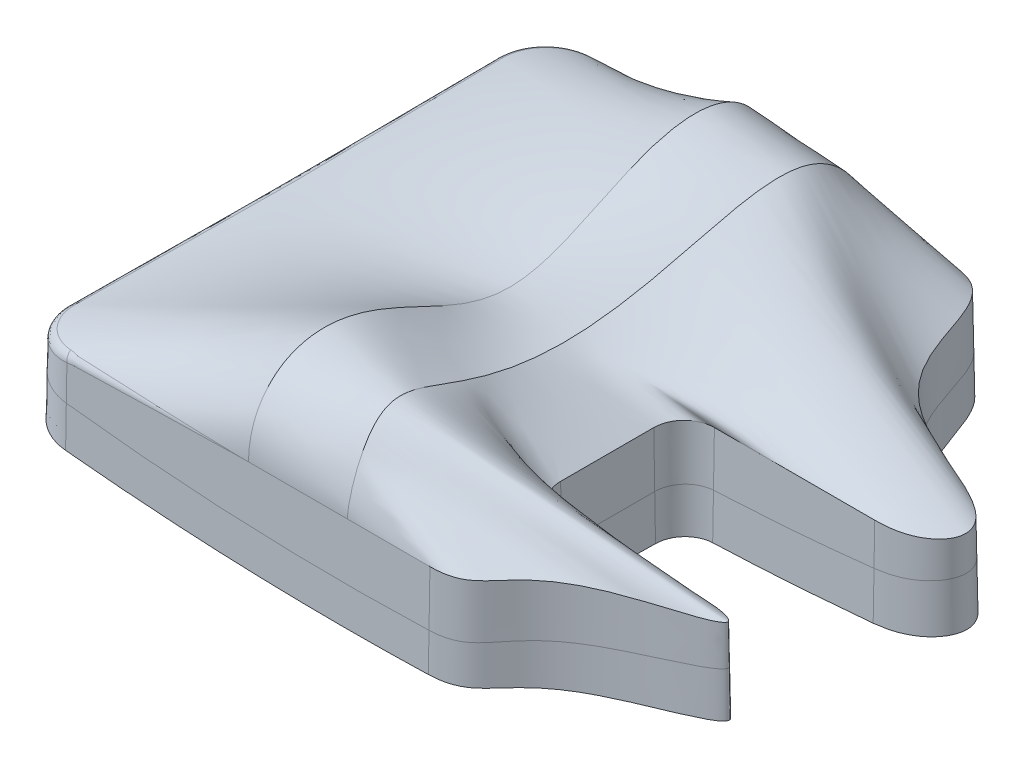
SolidWorks part; units mm, degrees
ref_plane "Front Plane" through (0, 0, 0) normal (0, 0, 1) x (1, 0, 0)
ref_plane "Top Plane" through (0, 0, 0) normal (0, 1, 0) x (1, 0, 0)
ref_plane "Right Plane" through (0, 0, 0) normal (1, 0, 0) x (0, 0, -1)
sketch "side sketch" plane through (0, 0, 0) normal (0, 0, 1) x (1, 0, 0)
  line L0 (0, 0) -> (142, 0) construction
  dimension "D1" = 142
sketch "Sketch2" plane through (0, 0, 0) normal (0, 0, 1) x (1, 0, 0)
  arc A0 (2, -22) -> (141, -22) centre (71.5, 573.9612) ccw
  point P3 (126.5, -23.5127)
  point P4 (25.5, -24.2729)
  point P5 (71.5, -26.0388)
  point P6 (0, 0)
  point P7 (0, 0)
  dimension "D1" = 600
  dimension "D2" = 22
  dimension "D3" = 2
  dimension "D4" = 139
  dimension "D5" = 55
  dimension "D6" = 46
sketch "side_smoke" plane through (0, 0, 0) normal (0, 0, 1) x (1, 0, 0)
  line L0 (3.5, -5.7802) -> (3.5, -8.0388) construction
  line L1 (3.5, -8.0388) -> (-11.5, 36) construction
  line L2 (-11.5, 36) -> (46.5, 28) construction
  line L3 (46.5, 28) -> (71.5, -71.0388) construction
  line L4 (71.5, -71.0388) -> (96.5, 28) construction
  line L5 (96.5, 28) -> (154.5, 36) construction
  line L6 (154.5, 36) -> (139.5, -8.0388) construction
  line L7 (139.5, -8.0388) -> (139.5, -5.7802) construction
  line L8 (71.5, -26.0388) -> (71.5, 118.356) construction
  arc A0 (3.5, -5.7802) -> (139.5, -5.7802) centre (71.5, 540) ccw
  arc A1 (2, -22) -> (141, -22) centre (71.5, 573.9612) ccw construction
  spline_without_curve S0
  point P3 (71.5, -10)
  point P4 (0, 0)
  point P5 (0, 0)
  point P13 (72.2321, -49.0173)
  point P14 (0, 0)
  point P15 (71.5, -72.5374)
  point P16 (0, 0)
  point P17 (71.5, -24.9262)
  point P18 (0, 0)
  point P19 (0, 0)
  point P20 (0, 0)
  point P21 (-6.2534, -17.0302)
  point P22 (3.0396, -8.1947)
  point P23 (0, 0)
  point P24 (141.4359, -2.8258)
  point P25 (146.4734, -5.6622)
  point P26 (-16.5, 36)
  point P27 (3.5, -6.5837)
  point P28 (0, 0)
  point P29 (0, 0)
  point P30 (0, 0)
  point P31 (0, 0)
  point P32 (0, 0)
  point P33 (0, 0)
ref_plane "right_plane" through (71.5507, 0, 0) normal (1, 0, 0) x (0, 0, -1)
sketch "right_side_smoke" plane through (71.5507, 0, 0) normal (1, 0, 0) x (0, 0, -1)
  line L0 (-54.7478, -7.8524) -> (55.2522, -7.8524) construction
  dimension "D1" = 110
sketch "Sketch7" plane through (71.5507, 0, 0) normal (1, 0, 0) x (0, 0, -1)
  arc A0 (55, -24.5835) -> (-55, -24.5835) centre (0, 1013.9612) cw
  point P3 (51.7591, -23.6324)
  point P4 (0, -26.0388)
  point P6 (0, 0)
  dimension "D1" = 1040
  dimension "D2" = 110
ref_plane "top_plane" through (0, -24.9381, 0) normal (0, 1, 0) x (1, 0, 0)
sketch "top_smoke" plane through (0, -24.9381, 0) normal (0, 1, 0) x (1, 0, 0)
  line L0 (51.7021, 57.6996) -> (50.2508, -50.1307) construction
  line L1 (-22.3362, 41.5701) -> (87.6638, 41.5701) construction
  point P4 (73.0576, -50.2135)
  point P5 (73.2358, -50.3341)
  dimension "D1" = 110
sketch "Sketch10" plane through (0, -24.9381, 0) normal (0, 1, 0) x (1, 0, 0)
  line L0 (2.8248, -45) -> (2.8248, 45)
  line L2 (12.8248, 55) -> (88.8248, 55)
  line L3 (2.8248, 0) -> (142.0694, 0) construction
  line L5 (12.8248, -55) -> (88.8248, -55)
  line L6 (122.6741, -31.5) -> (93.3884, -31.5)
  line L7 (93.3884, 0) -> (126.9566, 0)
  line L8 (88.8248, 55) -> (117.1528, 55) construction
  line L9 (87.3884, -25.5) -> (87.3884, -6)
  line L10 (117.1528, 55) -> (74.036, -6.0527) construction
  line L11 (74.036, -6.0527) -> (152.5402, 37.6831) construction
  line L12 (152.5402, 37.6831) -> (148.0627, 5.5651) construction
  line L13 (148.0627, 5.5651) -> (139.3029, 0) construction
  line L17 (139.3029, 0) -> (126.9566, 0) construction
  line L18 (88.8248, -55) -> (108.0821, -55) construction
  line L19 (108.0821, -55) -> (86.7311, -34.4421) construction
  line L20 (86.7311, -34.4421) -> (136.5026, -40.9296) construction
  line L21 (136.5026, -40.9296) -> (139.1754, -31.5) construction
  line L22 (139.1754, -31.5) -> (122.6741, -31.5) construction
  arc A0 (2.8248, 45) -> (12.8248, 55) centre (12.8248, 45) cw
  arc A3 (2.8248, -45) -> (12.8248, -55) centre (12.8248, -45) ccw
  arc A4 (93.3884, -31.5) -> (87.3884, -25.5) centre (93.3884, -25.5) cw
  arc A5 (87.3884, -6) -> (93.3884, 0) centre (93.3884, -6) cw
  spline_without_curve S0
  spline_without_curve S1
  point P3 (150.039, 39.6386)
  point P6 (74.5712, -1.441)
  point P8 (147.3346, 4.9109)
  point P9 (139.1754, -29.8798)
  point P10 (150.3044, 2.0381)
  point P11 (74.036, -6.0527)
  point P14 (152.5402, 37.6831)
  point P16 (148.0627, 5.5651)
  point P35 (108.0821, -53.1354)
  point P36 (2.8248, 0)
  point P37 (0, 0)
  point P38 (90.047, 57.1826)
  point P39 (86.7311, -34.4421)
  point P40 (2.8248, 1.6093)
  point P41 (0, 0)
  point P42 (0, 0)
  point P43 (0, 0)
  dimension "D1" = 90
  dimension "D5" = 19.5
  dimension "D6" = 6
  dimension "D2" = 10
  dimension "D7" = 74.036
  dimension "D4" = 68.6752
  dimension "D19" = 5.5651
  dimension "D20" = 37.6831
  dimension "D21" = 6.0527
  dimension "D22" = 34.4421
  dimension "D23" = 70.5187
  dimension "D24" = 9.4296
surface "Surface-Extrude1" sketch "Sketch10" parameters "D1"=40, "D3"=1
other "Boundary-Surface1"
surface "Surface-Trim2"
surface "Surface-Trim4"
sketch "Sketch12" plane through (71.5507, 0, 0) normal (1, 0, 0) x (0, 0, -1)
  line L9 (-54.6509, -4.9381) -> (-54.6509, 7.0619) construction
  line L10 (-54.6509, 7.0619) -> (-40.2851, 21.6067) construction
  line L11 (-40.2851, 21.6067) -> (-37.3184, 0.1528) construction
  line L13 (-37.3184, 0.1528) -> (0, 0.1528) construction
  line L14 (0, 8.9457) -> (0, -5.8451) construction
  line L17 (-54.6509, -4.9381) -> (-54.6509, 7.0619) construction
  line L18 (-54.6509, 7.0619) -> (-31.4071, 46.6672) construction
  line L19 (-31.4071, 46.6672) -> (-55.4523, -21.2066) construction
  line L20 (-55.4523, -21.2066) -> (25.3625, -21.2066) construction
  line L21 (25.3625, -21.2066) -> (24.9045, 46.6672) construction
  line L22 (24.9045, 46.6672) -> (54.6509, 7.0619) construction
  line L23 (54.6509, 7.0619) -> (54.6509, -4.9381) construction
  spline S0 degree 4 poles (-54.6509, -4.9381) (-54.6509, 7.0619) (-40.2851, 21.6067) (-37.3184, 0.1528) (0, 0.1528) knots 0 0 0 0 0 1 1 1 1 1
  spline_without_curve S1
  point P1 (52.9772, 11.3895)
  point P2 (-13.4504, 18.2963)
  point P4 (-54.6509, 6.7629)
  point P5 (-54.6509, 6.7629)
  point P10 (26.1624, 20.1246)
  point P11 (-11.6221, -18.8788)
  point P14 (14.3801, -12.1751)
  point P16 (0, 0)
  point P17 (-34.5772, 32.3131)
  point P24 (0, 0)
  point P25 (0, 0)
  point P26 (-24.2169, 28.8597)
  point P27 (0, 0)
  point P28 (-64.9269, 27.9723)
  point P29 (-55.5142, 21.0788)
  point P30 (0, 0)
  point P31 (-54.6509, 5.9759)
  point P32 (0, 0)
  point P33 (0, 0)
  point P34 (0, 0)
  point P35 (-61.4252, 27.7366)
  point P36 (-29.3824, -17.0373)
  point P37 (-48.7957, 30.4903)
  point P38 (6.3325, 37.9588)
  point P39 (-21.2228, 0.1528)
  point P40 (-45.4839, -22.1989)
  point P41 (17.0249, 38.3717)
  point P42 (25.3625, -23.6822)
  point P43 (0, 0)
  point P44 (-21.6267, 0.1528)
  point P45 (2.5499, -21.6795)
  point P46 (-29.8301, 0.1528)
  point P47 (-40.8624, 31.2993)
  point P48 (-30.0449, 0.1528)
  point P49 (-12.936, -27.7191)
  point P50 (-57.3991, 37.0586)
  point P51 (-15.21, -18.8247)
  point P52 (-60.2804, 50.8055)
  point P53 (-39.5404, 36.2297)
  point P54 (24.9045, 27.9949)
  point P55 (-44.0628, 23.8024)
  point P56 (-59.0296, 40.6281)
  point P57 (-48.0024, 40.1486)
  point P58 (-36.1178, -15.899)
  point P59 (-40.2234, 40.5869)
  point P60 (-30.0539, -20.2751)
  point P61 (-38.9766, 27.6628)
  point P63 (-37.3184, 0.1528)
  point P66 (-49.2864, -20.0531)
  point P67 (-40.2851, 21.6067)
  point P68 (-29.7076, 31.6499)
  point P69 (-23.2474, -24.4153)
  point P70 (-40.9802, -21.9881)
  point P71 (-30.4188, 47.6412)
  point P72 (-40.2575, 46.6672)
  point P73 (-55.4523, -21.2066)
  point P74 (0, 0)
  dimension "D1" = 24.9045
  dimension "D2" = 25.3625
  dimension "D3" = 31.4071
  dimension "D4" = 37.3184
  dimension "D5" = 40.2851
  dimension "D6" = 55.4523
  dimension "D7" = 21.6067
  dimension "D8" = 46.6672
  dimension "D9" = 14.5448
ref_plane "Plane4" through (25.5, 0, 0) normal (1, 0, 0) x (0, 0, -1)
sketch "Sketch15" plane through (25.5, 0, 0) normal (1, 0, 0) x (0, 0, -1)
  line L0 (-54.6509, -4.9381) -> (-54.6509, 7.0619) construction
  line L3 (-54.6509, 7.0619) -> (-29.6509, 19.6619) construction
  line L4 (-42, 7.8067) -> (0, 7.8067) construction
  line L7 (-29.6509, 19.6619) -> (-42, 7.8067) construction
  spline S1 degree 4 poles (-54.6509, -4.9381) (-54.6509, 7.0619) (-29.6509, 19.6619) (-42, 7.8067) (0, 7.8067) knots 0 0 0 0 0 1 1 1 1 1
  point P1 (-45.0685, 6.191)
  point P2 (-41.3093, 12.4958)
  point P4 (-17.0892, -7.3944)
  point P5 (0, 0)
  point P6 (0, 0)
  point P7 (-54.6509, 6.89)
  point P10 (-29.6509, 19.7318)
  point P13 (0, 0)
  point P14 (-30.3407, 14.2792)
  point P17 (-42.5415, 7.8067)
  dimension "D1" = 12
  dimension "D2" = 25
  dimension "D3" = 12.6
  dimension "D4" = 42
sketch "Sketch17" plane through (0, 0, 0) normal (0, 0, 1) x (1, 0, 0)
  line L2 (3.5, -5.7802) -> (3.5, -8.0388) construction
  line L3 (3.5, -8.0388) -> (-11.5, 36) construction
  line L4 (-11.5, 36) -> (46.5, 28) construction
  line L6 (46.5, 28) -> (71.5, -71.0388) construction
  line L9 (71.5, -71.0388) -> (96.5, 28) construction
  line L11 (96.5, 28) -> (154.5, 36) construction
  line L13 (154.5, 36) -> (139.5, -8.0388) construction
  line L16 (139.5, -8.0388) -> (139.5, -5.7802) construction
  line L17 (71.5, -26.0388) -> (71.5, 118.356) construction
  spline_without_curve S1
  point P2 (0, 0)
  point P3 (0, 0)
  dimension "D1" = 2.2586
  dimension "D5" = 58
  dimension "D7" = 58
  dimension "D8" = 15
  dimension "D9" = 45
ref_plane "Plane5" through (50.8248, 0, 0) normal (1, 0, 0) x (0, 0, -1)
sketch "Sketch19" plane through (50.8248, 0, 0) normal (1, 0, 0) x (0, 0, -1)
  line L5 (-54.6509, -4.9381) -> (-54.6509, 22.0619) construction
  line L6 (-54.6509, 22.0619) -> (-15, 26) construction
  line L9 (-15, 26) -> (-6, -21) construction
  line L10 (-6, -21) -> (6, -21) construction
  line L11 (6, -21) -> (15, 26) construction
  line L12 (15, 26) -> (54.6509, 22.0619) construction
  line L14 (54.6509, 22.0619) -> (54.6509, -4.9381) construction
  line L16 (-6, -25.8107) -> (-6, -4.9381) construction
  line L18 (0, -8.0388) -> (0, 36) construction
  line L19 (0, -26.0388) -> (0, 118.356) construction
  spline S0 degree 4 poles (-54.6509, -4.9381) (-54.6509, 7.0619) (-29.6509, 19.6619) (-42, 7.8067) (0, 7.8067) knots 0 0 0 0 0 1 1 1 1 1 construction
  spline_without_curve S1
  point P1 (6.448, 20.2623)
  point P2 (-54.6509, 17.58)
  point P3 (-11.5116, -13.5577)
  point P4 (10.9962, -9.7092)
  point P7 (21.3754, 27.8426)
  point P8 (-5.9138, 12.3321)
  point P9 (-54.6509, 27.8426)
  point P10 (26.0403, 41.0208)
  point P11 (-15.0102, 26.9097)
  point P12 (60.4434, 20.3789)
  point P13 (20.7923, 18.7462)
  point P14 (7.3809, 25.277)
  point P15 (0, 0)
  point P18 (0, 0)
  point P19 (0, 0)
  point P20 (-54.6509, 21.1419)
  point P21 (-10.5926, -18.3016)
  point P22 (54.6509, 30.7912)
  point P23 (-6, -21.0102)
  point P33 (-54.6509, 22.6655)
  point P34 (-54.6509, 21.1419)
  point P39 (-15.3326, 29.7754)
sketch3d "3DSketch8"
  line L0 (93.3884, -4.9381, 31.8491) -> (122.6741, -4.9381, 31.8491) construction
  line L1 (87.0393, -4.9381, 6) -> (87.0393, -4.9381, 25.5) construction
  line L2 (126.9566, -4.9381, -0.3491) -> (93.3884, -4.9381, -0.3491) construction
  line L6 (93.3884, -4.9381, 31.8491) -> (122.6741, -4.9381, 31.8491)
  line L7 (87.0393, -4.9381, 6) -> (87.0393, -4.9381, 25.5)
  line L8 (126.9566, -4.9381, -0.3491) -> (93.3884, -4.9381, -0.3491)
  line L12 (88.8248, -4.9381, 54.6509) -> (71.5507, -4.9381, 54.6509)
  line L14 (88.8248, -4.9381, -54.6509) -> (71.5507, -4.9381, -54.6509)
  line L15 (88.8248, -4.9381, 54.6509) -> (12.8248, -4.9381, 54.6509) construction
  line L16 (71.5507, 7.0619, -54.6509) -> (71.5507, -4.9381, -54.6509) construction
  arc A0 (93.3884, -4.9381, 31.8491) -> (87.0393, -4.9381, 25.5) centre (93.3884, -4.9381, 25.5) ccw construction
  arc A1 (87.0393, -4.9381, 6) -> (93.3884, -4.9381, -0.3491) centre (93.3884, -4.9381, 6) ccw construction
  arc A4 (93.3884, -4.9381, 31.8491) -> (87.0393, -4.9381, 25.5) centre (93.3884, -4.9381, 25.5) ccw
  arc A5 (87.0393, -4.9381, 6) -> (93.3884, -4.9381, -0.3491) centre (93.3884, -4.9381, 6) ccw
  spline S0 degree 3 poles (681.533, -4.9381, 1929.594) (-251.5349, -4.9381, 86.8586) (90.775, -4.9381, 26.2449) (127.5395, -4.9381, 32.2494) (128.0349, -4.9381, 32.3596) (128.865, -4.9381, 32.6011) (129.1998, -4.9381, 32.733) (129.5744, -4.9381, 32.9315) (129.678, -4.9381, 32.9977) (129.8423, -4.9381, 33.1245) (129.9027, -4.9381, 33.1849) (129.9858, -4.9381, 33.2918) (130.0086, -4.9381, 33.3374) (130.0331, -4.9381, 33.4161) (130.0362, -4.9381, 33.4499) (130.027, -4.9381, 33.53) (130.0136, -4.9381, 33.5772) (129.9553, -4.9381, 33.6921) (129.91, -4.9381, 33.7589) (129.719, -4.9381, 33.9773) (129.5178, -4.9381, 34.1451) (128.9825, -4.9381, 34.4942) (128.6491, -4.9381, 34.6764) (127.8699, -4.9381, 35.0485) (127.4241, -4.9381, 35.2387) (125.9452, -4.9381, 35.8192) (124.7704, -4.9381, 36.2195) (122.1865, -4.9381, 37.0562) (120.7778, -4.9381, 37.493) (117.8682, -4.9381, 38.4218) (116.3678, -4.9381, 38.9141) (113.4049, -4.9381, 39.9732) (111.9429, -4.9381, 40.5402) (109.1609, -4.9381, 41.7615) (107.8414, -4.9381, 42.4161) (106.0177, -4.9381, 43.4635) (105.4355, -4.9381, 43.8234) (104.3255, -4.9381, 44.563) (103.7979, -4.9381, 44.9426) (102.797, -4.9381, 45.718) (102.3238, -4.9381, 46.1138) (101.4275, -4.9381, 46.916) (101.0044, -4.9381, 47.3225) (100.1992, -4.9381, 48.1383) (99.8171, -4.9381, 48.5477) (99.0799, -4.9381, 49.3595) (98.7247, -4.9381, 49.762) (98.0216, -4.9381, 50.5479) (97.6738, -4.9381, 50.9313) (96.9602, -4.9381, 51.6658) (96.5945, -4.9381, 52.0167) (95.8137, -4.9381, 52.6723) (95.3987, -4.9381, 52.9771) (94.4779, -4.9381, 53.5265) (93.9721, -4.9381, 53.7714) (92.8172, -4.9381, 54.1839) (92.1678, -4.9381, 54.3516) (65.1357, -4.9381, 58.5534) (-85.9369, -4.9381, 0.2019) (-1741.3063, -4.9381, -751.5696) knots -1.916988 -1.916988 -1.916988 -1.916988 0.0625 0.0625 0.09375 0.09375 0.125 0.125 0.140625 0.140625 0.15625 0.15625 0.171875 0.171875 0.1875 0.1875 0.203125 0.203125 0.21875 0.21875 0.25 0.25 0.28125 0.28125 0.3125 0.3125 0.375 0.375 0.4375 0.4375 0.5 0.5 0.5625 0.5625 0.625 0.625 0.65625 0.65625 0.6875 0.6875 0.71875 0.71875 0.75 0.75 0.78125 0.78125 0.8125 0.8125 0.84375 0.84375 0.875 0.875 0.90625 0.90625 0.9375 0.9375 0.96875 0.96875 2.062005 2.062005 2.062005 2.062005 only from (122.6741, -4.9381, 31.8491) to (88.8248, -4.9381, 54.6509) construction
  spline S1 degree 3 poles (-1474.6116, -4.9381, 1191.8966) (-96.9775, -4.9381, 38.405) (61.8806, -4.9381, -59.9718) (91.8705, -4.9381, -54.3133) (92.4979, -4.9381, -54.1213) (93.6337, -4.9381, -53.64) (94.1422, -4.9381, -53.3506) (95.0667, -4.9381, -52.6912) (95.4827, -4.9381, -52.321) (96.6237, -4.9381, -51.1099) (97.2424, -4.9381, -50.1682) (98.3201, -4.9381, -48.1245) (98.7785, -4.9381, -47.0231) (99.632, -4.9381, -44.7539) (100.0271, -4.9381, -43.5862) (100.8289, -4.9381, -41.2537) (101.2355, -4.9381, -40.0888) (102.1127, -4.9381, -37.81) (102.5833, -4.9381, -36.6959) (103.6208, -4.9381, -34.5499) (104.1878, -4.9381, -33.5178) (105.4327, -4.9381, -31.5533) (106.1106, -4.9381, -30.6208) (107.5774, -4.9381, -28.8617) (108.3661, -4.9381, -28.035) (110.0427, -4.9381, -26.4844) (110.9303, -4.9381, -25.7604) (112.7846, -4.9381, -24.4048) (113.7511, -4.9381, -23.7731) (116.7308, -4.9381, -21.9939) (118.8248, -4.9381, -20.9625) (122.9903, -4.9381, -19.0678) (125.0604, -4.9381, -18.2032) (127.9666, -4.9381, -16.9345) (128.9023, -4.9381, -16.5165) (130.6809, -4.9381, -15.6786) (131.5237, -4.9381, -15.2586) (133.0932, -4.9381, -14.4087) (133.8198, -4.9381, -13.9787) (135.1381, -4.9381, -13.1051) (135.7296, -4.9381, -12.6616) (136.7645, -4.9381, -11.7623) (137.2078, -4.9381, -11.3066) (137.9401, -4.9381, -10.3891) (138.2291, -4.9381, -9.9275) (138.6553, -4.9381, -9.0058) (138.7927, -4.9381, -8.5459) (138.9241, -4.9381, -7.6328) (138.9181, -4.9381, -7.1794) (138.7697, -4.9381, -6.2836) (138.627, -4.9381, -5.8411) (138.2113, -4.9381, -4.9782) (137.9382, -4.9381, -4.558) (136.94, -4.9381, -3.3553) (136.0353, -4.9381, -2.6329) (134.4205, -4.9381, -1.7581) (133.8396, -4.9381, -1.5009) (132.61, -4.9381, -1.064) (131.9613, -4.9381, -0.8844) (130.6111, -4.9381, -0.6044) (129.9095, -4.9381, -0.5042) (82.4708, -4.9381, 3.6871) (-53.3136, -4.9381, -144.3967) (286.5441, -4.9382, 1988.7173) knots -0.636401 -0.636401 -0.636401 -0.636401 0.015625 0.015625 0.03125 0.03125 0.046875 0.046875 0.0625 0.0625 0.09375 0.09375 0.125 0.125 0.15625 0.15625 0.1875 0.1875 0.21875 0.21875 0.25 0.25 0.28125 0.28125 0.3125 0.3125 0.34375 0.34375 0.375 0.375 0.4375 0.4375 0.5 0.5 0.53125 0.53125 0.5625 0.5625 0.59375 0.59375 0.625 0.625 0.65625 0.65625 0.6875 0.6875 0.71875 0.71875 0.75 0.75 0.78125 0.78125 0.8125 0.8125 0.875 0.875 0.90625 0.90625 0.9375 0.9375 0.96875 0.96875 2.988562 2.988562 2.988562 2.988562 only from (88.8248, -4.9381, -54.6509) to (126.9566, -4.9381, -0.3491) construction
  spline S2 degree 3 poles (122.6741, -4.9381, 31.8491) (124.3775, -4.9381, 31.8491) (125.8254, -4.9381, 31.9694) (127.5395, -4.9381, 32.2494) (128.0349, -4.9381, 32.3596) (128.865, -4.9381, 32.6011) (129.1998, -4.9381, 32.733) (129.5744, -4.9381, 32.9315) (129.678, -4.9381, 32.9977) (129.8423, -4.9381, 33.1245) (129.9027, -4.9381, 33.1849) (129.9858, -4.9381, 33.2918) (130.0086, -4.9381, 33.3374) (130.0331, -4.9381, 33.4161) (130.0362, -4.9381, 33.4499) (130.027, -4.9381, 33.53) (130.0136, -4.9381, 33.5772) (129.9553, -4.9381, 33.6921) (129.91, -4.9381, 33.7589) (129.719, -4.9381, 33.9773) (129.5178, -4.9381, 34.1451) (128.9825, -4.9381, 34.4942) (128.6491, -4.9381, 34.6764) (127.8699, -4.9381, 35.0485) (127.4241, -4.9381, 35.2387) (125.9452, -4.9381, 35.8192) (124.7704, -4.9381, 36.2195) (122.1865, -4.9381, 37.0562) (120.7778, -4.9381, 37.493) (117.8682, -4.9381, 38.4218) (116.3678, -4.9381, 38.9141) (113.4049, -4.9381, 39.9732) (111.9429, -4.9381, 40.5402) (109.1609, -4.9381, 41.7615) (107.8414, -4.9381, 42.4161) (106.0177, -4.9381, 43.4635) (105.4355, -4.9381, 43.8234) (104.3255, -4.9381, 44.563) (103.7979, -4.9381, 44.9426) (102.797, -4.9381, 45.718) (102.3238, -4.9381, 46.1138) (101.4275, -4.9381, 46.916) (101.0044, -4.9381, 47.3225) (100.1992, -4.9381, 48.1383) (99.8171, -4.9381, 48.5477) (99.0799, -4.9381, 49.3595) (98.7247, -4.9381, 49.762) (98.0216, -4.9381, 50.5479) (97.6738, -4.9381, 50.9313) (96.9602, -4.9381, 51.6658) (96.5945, -4.9381, 52.0167) (95.8137, -4.9381, 52.6723) (95.3987, -4.9381, 52.9771) (94.4779, -4.9381, 53.5265) (93.9721, -4.9381, 53.7714) (92.8172, -4.9381, 54.1839) (92.1678, -4.9381, 54.3516) (90.6654, -4.9381, 54.5851) (89.8122, -4.9381, 54.6509) (88.8248, -4.9381, 54.6509) knots 0 0 0 0 0.0625 0.0625 0.09375 0.09375 0.125 0.125 0.140625 0.140625 0.15625 0.15625 0.171875 0.171875 0.1875 0.1875 0.203125 0.203125 0.21875 0.21875 0.25 0.25 0.28125 0.28125 0.3125 0.3125 0.375 0.375 0.4375 0.4375 0.5 0.5 0.5625 0.5625 0.625 0.625 0.65625 0.65625 0.6875 0.6875 0.71875 0.71875 0.75 0.75 0.78125 0.78125 0.8125 0.8125 0.84375 0.84375 0.875 0.875 0.90625 0.90625 0.9375 0.9375 0.96875 0.96875 1 1 1 1
  spline S3 degree 3 poles (88.8248, -4.9381, -54.6509) (89.6905, -4.9381, -54.6509) (90.4668, -4.9381, -54.5781) (91.8705, -4.9381, -54.3133) (92.4979, -4.9381, -54.1213) (93.6337, -4.9381, -53.64) (94.1422, -4.9381, -53.3506) (95.0667, -4.9381, -52.6912) (95.4827, -4.9381, -52.321) (96.6237, -4.9381, -51.1099) (97.2424, -4.9381, -50.1682) (98.3201, -4.9381, -48.1245) (98.7785, -4.9381, -47.0231) (99.632, -4.9381, -44.7539) (100.0271, -4.9381, -43.5862) (100.8289, -4.9381, -41.2537) (101.2355, -4.9381, -40.0888) (102.1127, -4.9381, -37.81) (102.5833, -4.9381, -36.6959) (103.6208, -4.9381, -34.5499) (104.1878, -4.9381, -33.5178) (105.4327, -4.9381, -31.5533) (106.1106, -4.9381, -30.6208) (107.5774, -4.9381, -28.8617) (108.3661, -4.9381, -28.035) (110.0427, -4.9381, -26.4844) (110.9303, -4.9381, -25.7604) (112.7846, -4.9381, -24.4048) (113.7511, -4.9381, -23.7731) (116.7308, -4.9381, -21.9939) (118.8248, -4.9381, -20.9625) (122.9903, -4.9381, -19.0678) (125.0604, -4.9381, -18.2032) (127.9666, -4.9381, -16.9345) (128.9023, -4.9381, -16.5165) (130.6809, -4.9381, -15.6786) (131.5237, -4.9381, -15.2586) (133.0932, -4.9381, -14.4087) (133.8198, -4.9381, -13.9787) (135.1381, -4.9381, -13.1051) (135.7296, -4.9381, -12.6616) (136.7645, -4.9381, -11.7623) (137.2078, -4.9381, -11.3066) (137.9401, -4.9381, -10.3891) (138.2291, -4.9381, -9.9275) (138.6553, -4.9381, -9.0058) (138.7927, -4.9381, -8.5459) (138.9241, -4.9381, -7.6328) (138.9181, -4.9381, -7.1794) (138.7697, -4.9381, -6.2836) (138.627, -4.9381, -5.8411) (138.2113, -4.9381, -4.9782) (137.9382, -4.9381, -4.558) (136.94, -4.9381, -3.3553) (136.0353, -4.9381, -2.6329) (134.4205, -4.9381, -1.7581) (133.8396, -4.9381, -1.5009) (132.61, -4.9381, -1.064) (131.9613, -4.9381, -0.8844) (130.6111, -4.9381, -0.6044) (129.9095, -4.9381, -0.5042) (128.464, -4.9381, -0.3765) (127.7199, -4.9381, -0.3491) (126.9566, -4.9381, -0.3491) knots 0 0 0 0 0.015625 0.015625 0.03125 0.03125 0.046875 0.046875 0.0625 0.0625 0.09375 0.09375 0.125 0.125 0.15625 0.15625 0.1875 0.1875 0.21875 0.21875 0.25 0.25 0.28125 0.28125 0.3125 0.3125 0.34375 0.34375 0.375 0.375 0.4375 0.4375 0.5 0.5 0.53125 0.53125 0.5625 0.5625 0.59375 0.59375 0.625 0.625 0.65625 0.65625 0.6875 0.6875 0.71875 0.71875 0.75 0.75 0.78125 0.78125 0.8125 0.8125 0.875 0.875 0.90625 0.90625 0.9375 0.9375 0.96875 0.96875 1 1 1 1
  spline S4 degree 7 poles (71.5507, -4.9381, 54.6509) (71.5507, 7.0619, 54.6509) (71.5507, 46.6672, 31.4071) (71.5507, -21.2066, 55.4523) (71.5507, -21.2066, -25.3625) (71.5507, 46.6672, -24.9045) (71.5507, 7.0619, -54.6509) (71.5507, -4.9381, -54.6509) knots 0 0 0 0 0 0 0 0 1 1 1 1 1 1 1 1 construction
  point P3 (93.3884, -11.2872, 25.5)
  point P5 (93.3884, -11.2872, 6)
  point P7 (93.3884, -11.2872, 25.5)
  point P11 (0, 0, 0)
  point P13 (93.3884, -11.2872, 6)
  point P17 (50.8248, -4.9381, 54.6509)
  point P18 (0, 0, 0)
  point P19 (0, 0, 0)
  point P20 (50.8248, -4.9381, -54.6509)
  point P21 (0, 0, 0)
  point P22 (0, 0, 0)
  point P23 (71.6189, -4.9381, 54.6509)
  point P26 (71.5507, -4.9381, 54.6509)
  point P29 (0, 0, 0)
  point P30 (71.5507, -4.9381, -54.6509)
other "Boundary-Surface9"
sketch3d "3DSketch10"
  line L5 (3.1739, -4.9381, 45) -> (3.1739, -4.9381, -45) construction
  line L11 (3.1739, -4.9381, 45) -> (3.1739, -4.9381, -45)
  line L12 (12.8248, -4.9381, -54.6509) -> (50.8248, -4.9381, -54.6509)
  line L13 (88.8248, -4.9381, -54.6509) -> (71.5507, -4.9381, -54.6509) construction
  line L14 (12.8248, -4.9381, -54.6509) -> (88.8248, -4.9381, -54.6509) construction
  line L15 (12.8248, -4.9381, 54.6509) -> (50.8248, -4.9381, 54.6509)
  line L16 (88.8248, -4.9381, 54.6509) -> (12.8248, -4.9381, 54.6509) construction
  arc A0 (3.1739, -4.9381, 45) -> (12.8248, -4.9381, 54.6509) centre (12.8248, -4.9381, 45) ccw construction
  arc A3 (12.8248, -4.9381, -54.6509) -> (3.1739, -4.9381, -45) centre (12.8248, -4.9381, -45) ccw construction
  arc A4 (3.1739, -4.9381, 45) -> (12.8248, -4.9381, 54.6509) centre (12.8248, -4.9381, 45) ccw
  arc A7 (12.8248, -4.9381, -54.6509) -> (3.1739, -4.9381, -45) centre (12.8248, -4.9381, -45) ccw
  point P3 (12.8248, 4.7128, 45)
  point P5 (12.8248, 4.7128, 45)
  point P11 (12.8248, 4.7128, -45)
  point P12 (50.8248, -4.9381, -54.6509)
  point P13 (0, 0, 0)
  point P14 (50.8248, -4.9381, 54.6509)
  point P17 (0, 0, 0)
  point P29 (12.8248, 4.7128, -45)
sketch "Sketch20" plane through (0, 0, 0) normal (0, 0, 1) x (1, 0, 0)
  line L1 (3.5, -5.7802) -> (3.5, 18.0722) construction
  line L2 (3.5, 18.0722) -> (24.5635, 24.2079) construction
  line L3 (24.5635, 24.2079) -> (28.3388, -0.6173) construction
  line L4 (28.3388, -0.6173) -> (50.8248, -0.6173) construction
  spline S0 degree 4 poles (3.5, -5.7802) (3.5, 18.0722) (24.5635, 24.2079) (28.3388, -0.6173) (50.8248, -0.6173) knots 0 0 0 0 0 1 1 1 1 1
  point P1 (0, 0)
  point P2 (9.0118, 17.9745)
  point P3 (28.3934, -2.1842)
  point P4 (24.5635, 24.2079)
  point P5 (3.5, 18.0722)
  dimension "D1" = 23.8524
  dimension "D2" = 6.1357
  dimension "D3" = 24.8388
  dimension "D4" = 21.0635
other "Boundary-Surface11"
other "Boundary-Surface13"
surface "Surface-Knit3"
fillet "Fillet2" radius 2 4 edges
shell "Shell3" thickness 1
sketch "Sketch22" plane through (0, 0, 0) normal (0, 0, 1) x (1, 0, 0)
  line L1 (71.5, -26.0388) -> (71.5, 118.356) construction
  arc A2 (1.5, -11.7578) -> (141.5, -11.7578) centre (71.5, 483.3179) ccw
  point P1 (0, 0)
  point P2 (71.5, -16.6821)
  dimension "D3" = 500
  dimension "D1" = 70
  dimension "D2" = 5.3471
split "Split2" trim tools "Sketch22" bodies to split 121 resulting bodies 125 126
other "Save Bodies1"
equation "\"D5@side_smoke\" = \"D4@side_smoke\""
equation "\"D9@side_smoke\" = \"D8@side_smoke\""
equation "\"D7@side_smoke\" = \"D6@side_smoke\""
equation "\"D2@Sketch19\"=\"D1@Sketch19\""
